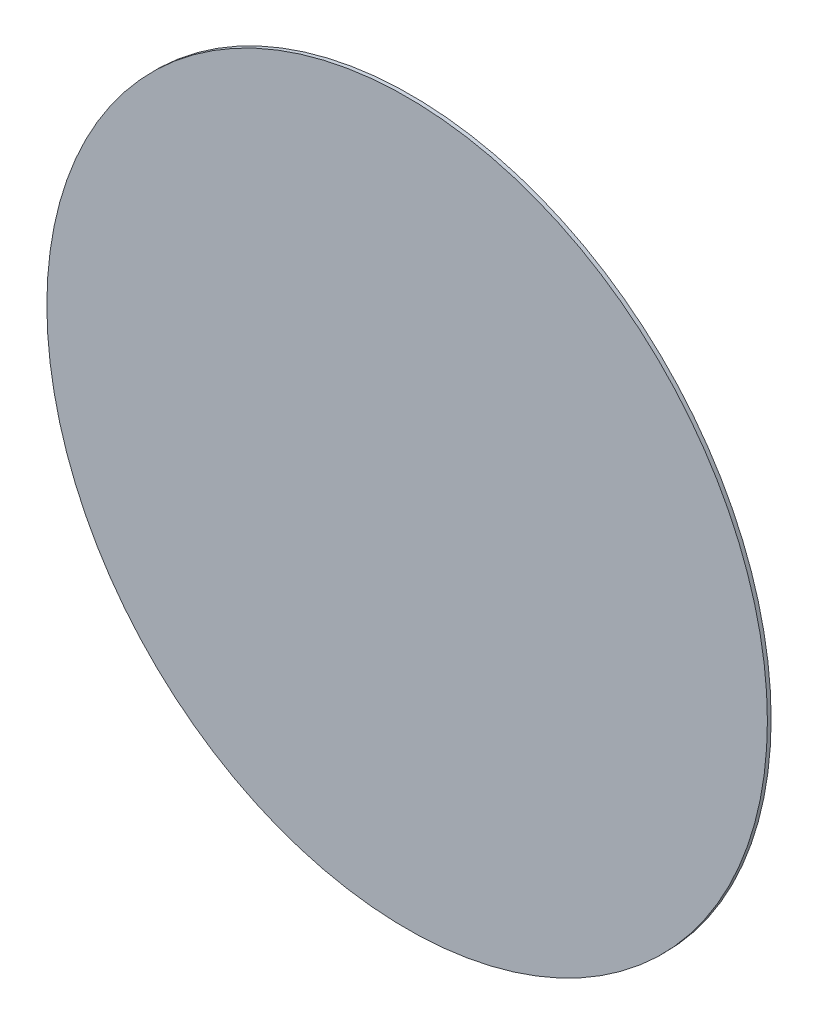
SolidWorks part; units mm, degrees
ref_plane "Front" through (0, 0, 0) normal (0, 0, 1) x (1, 0, 0)
ref_plane "Top" through (0, 0, 0) normal (0, 1, 0) x (1, 0, 0)
ref_plane "Right" through (0, 0, 0) normal (1, 0, 0) x (0, 0, -1)
sketch "Sketch1" plane through (0, 0, 0) normal (0, 0, 1) x (1, 0, 0)
  circle A0 centre (0, 0) radius 12.5
  dimension "D1" = 25
extrude "Extrude1" add sketch "Sketch1" along normal blind 0.13
